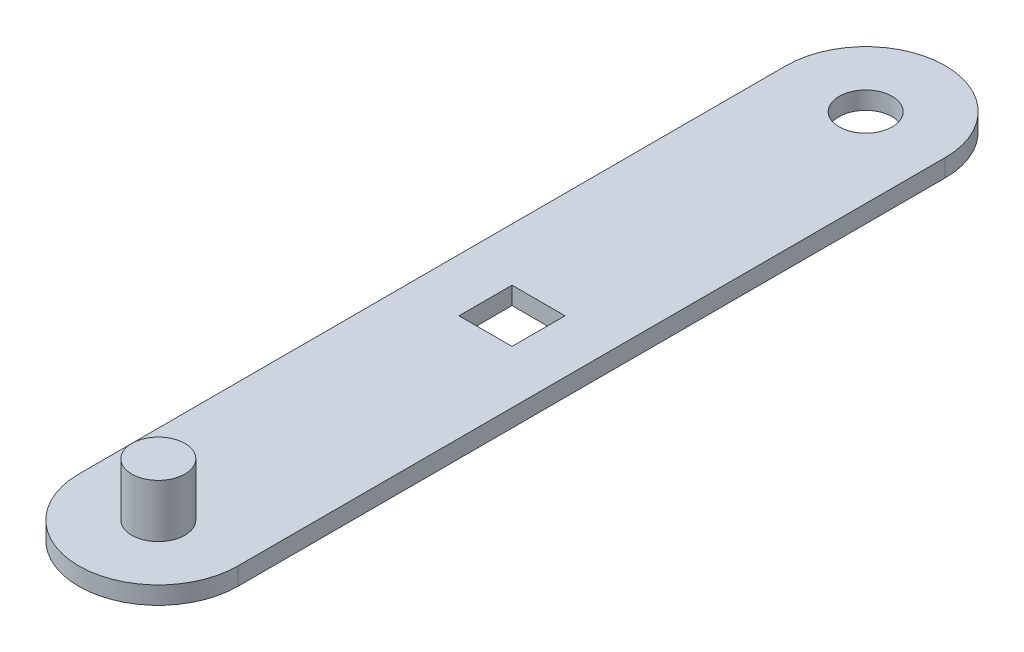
SolidWorks part; units mm, degrees
ref_plane "Front Plane" through (0, 0, 0) normal (0, 0, 1) x (1, 0, 0)
ref_plane "Top Plane" through (0, 0, 0) normal (0, 1, 0) x (1, 0, 0)
ref_plane "Right Plane" through (0, 0, 0) normal (1, 0, 0) x (0, 0, -1)
sketch "Sketch1" plane through (0, 0, 0) normal (0, 1, 0) x (1, 0, 0)
  line L1 (-225, -1000) -> (225, -1000)
  line L2 (-225, -1000) -> (-225, 1000)
  line L3 (-225, 1000) -> (225, 1000)
  line L4 (225, -1000) -> (225, 1000)
  line L5 (-225, -1000) -> (225, 1000) construction
  line L6 (-225, 1000) -> (225, -1000) construction
  arc A0 (225, -1000) -> (-225, -1000) centre (0, -1000) cw
  arc A1 (225, 1000) -> (-225, 1000) centre (0, 1000) ccw
  point P0 (0, 0)
  dimension "D1" = 2000
  dimension "D2" = 450
extrude "Boss-Extrude1" add sketch "Sketch1" along normal blind 50 contours L1 L4 L3 L2 | L3 A1 | A0 L1
sketch "Sketch2" plane through (0, 50, 0) normal (0, 1, 0) x (1, 0, 0)
  line L0 (-225, -1000) -> (225, -1000)
  line L1 (-225, -1000) -> (-225, 1000) construction
  circle A0 centre (0, -1000) radius 75
extrude "Boss-Extrude2" add sketch "Sketch2" along normal blind 150 contours L0 A0 | L0 A0
sketch "Sketch3" plane through (0, 50, 0) normal (0, 1, 0) x (1, 0, 0)
  line L0 (-225, 1000) -> (225, 1000)
  circle A0 centre (0, 1000) radius 75
extrude "Cut-Extrude2" cut sketch "Sketch3" against normal blind 250 contours L0 A0 | L0 A0
sketch "Sketch5" plane through (0, 50, 0) normal (0, 1, 0) x (1, 0, 0)
  line L1 (-75, -75) -> (75, -75)
  line L2 (-75, -75) -> (-75, 75)
  line L3 (-75, 75) -> (75, 75)
  line L4 (75, -75) -> (75, 75)
  line L5 (-75, -75) -> (75, 75) construction
  line L6 (-75, 75) -> (75, -75) construction
  point P0 (0, 0)
  dimension "D1" = 150
  dimension "D2" = 150
extrude "Cut-Extrude3" cut sketch "Sketch5" against normal through all
